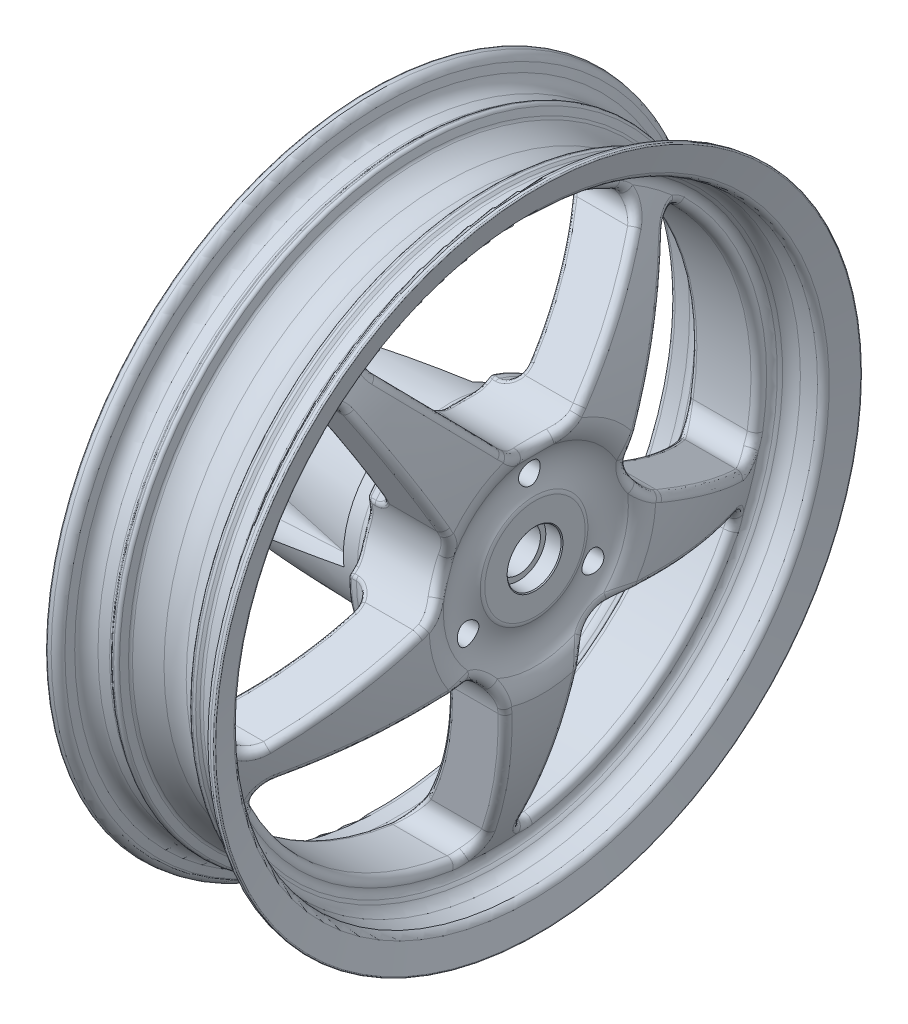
SolidWorks part; units mm, degrees
ref_plane "Plan de face" through (0, 0, 0) normal (0, 0, 1) x (1, 0, 0)
ref_plane "Plan de dessus" through (0, 0, 0) normal (0, 1, 0) x (1, 0, 0)
ref_plane "Plan de droite" through (0, 0, 0) normal (1, 0, 0) x (0, 0, -1)
sketch "Esquisse1" plane through (0, 0, 0) normal (0, 0, 1) x (1, 0, 0)
  line L0 (0, 0) -> (197.9907, 0) construction
  line L1 (0, 12) -> (0, 49)
  line L2 (0, 49) -> (71.1972, 51.8104)
  line L3 (76, 56.8065) -> (76, 60)
  line L4 (78, 62) -> (80.8642, 62)
  line L5 (-47.476, 147.5) -> (142.6594, 147.5) construction
  line L6 (26.2413, 179.0996) -> (29.9338, 165.3187)
  line L7 (26, 180) -> (26, -43.8427) construction
  line L8 (33.4489, 162.3692) -> (42.2177, 161.6021)
  line L9 (119.7587, 179.0996) -> (116.0662, 165.3187)
  line L10 (120, 180) -> (120, 33.2219) construction
  line L11 (112.5511, 162.3692) -> (103.7823, 161.6021)
  line L12 (26, 180) -> (120, 180) construction
  line L13 (26.9194, 179.8468) -> (28.8254, 179.5291)
  line L14 (32.833, 175.8912) -> (33.9769, 171.6223)
  line L15 (41.007, 165.7233) -> (46.9739, 165.2012)
  line L16 (48.4338, 165.6615) -> (49.7144, 166.7361)
  line L17 (51, 167.204) -> (51.2, 167.204)
  line L18 (53.0913, 165.8544) -> (54.3647, 162.1511)
  line L19 (73, 180) -> (73, 147.5) construction
  line L20 (92.9087, 165.8544) -> (91.6353, 162.1511)
  line L21 (95, 167.204) -> (94.8, 167.204)
  line L22 (97.5662, 165.6615) -> (96.2856, 166.7361)
  line L23 (104.993, 165.7233) -> (99.0261, 165.2012)
  line L24 (113.167, 175.8912) -> (112.0231, 171.6223)
  line L25 (119.0806, 179.8468) -> (117.1746, 179.5291)
  line L26 (118, 12) -> (118, 27.8791)
  line L27 (0, 12) -> (118, 12)
  arc A0 (48.7941, 158.313) -> (54.3276, 153.3994) centre (73, 180) ccw
  arc A1 (42.2177, 161.6021) -> (48.7941, 158.313) centre (41.3461, 151.6401) cw
  arc A2 (103.7823, 161.6021) -> (97.2059, 158.313) centre (104.6539, 151.6401) ccw
  arc A3 (29.9338, 165.3187) -> (33.4489, 162.3692) centre (33.7975, 166.354) ccw
  arc A4 (116.0662, 165.3187) -> (112.5511, 162.3692) centre (112.2025, 166.354) cw
  arc A5 (33.9769, 171.6223) -> (41.007, 165.7233) centre (41.7043, 173.6928) ccw
  arc A6 (46.9739, 165.2012) -> (48.4338, 165.6615) centre (47.1482, 167.1936) ccw
  arc A7 (49.7144, 166.7361) -> (51, 167.204) centre (51, 165.204) cw
  arc A8 (53.0913, 165.8544) -> (51.2, 167.204) centre (51.2, 165.204) ccw
  arc A9 (55.265, 160.8356) -> (73, 154) centre (73.9861, 182.9832) ccw
  arc A10 (54.3647, 162.1511) -> (55.265, 160.8356) centre (57.2017, 163.1267) ccw
  arc A11 (28.8254, 179.5291) -> (32.833, 175.8912) centre (28.0034, 174.5971) cw
  arc A12 (26.2413, 179.0996) -> (26.9194, 179.8468) centre (26.8208, 179.2549) cw
  arc A13 (90.735, 160.8356) -> (73, 154) centre (72.0139, 182.9832) cw
  arc A14 (91.6353, 162.1511) -> (90.735, 160.8356) centre (88.7983, 163.1267) cw
  arc A15 (92.9087, 165.8544) -> (94.8, 167.204) centre (94.8, 165.204) cw
  arc A16 (96.2856, 166.7361) -> (95, 167.204) centre (95, 165.204) ccw
  arc A17 (99.0261, 165.2012) -> (97.5662, 165.6615) centre (98.8518, 167.1936) cw
  arc A18 (112.0231, 171.6223) -> (104.993, 165.7233) centre (104.2957, 173.6928) cw
  arc A19 (117.1746, 179.5291) -> (113.167, 175.8912) centre (117.9966, 174.5971) ccw
  arc A20 (119.7587, 179.0996) -> (119.0806, 179.8468) centre (119.1792, 179.2549) ccw
  arc A21 (88.7655, 71.2525) -> (55.5183, 152.2206) centre (-98.8916, 41.5065) ccw
  arc A22 (80.8642, 62) -> (88.7655, 71.2525) centre (80.8642, 70) ccw
  arc A23 (95.7617, 156.8018) -> (97.2059, 158.313) centre (73, 180) ccw
  arc A24 (54.3276, 153.3994) -> (55.5183, 152.2206) centre (51.4549, 149.307) cw
  arc A25 (94.8259, 150.9292) -> (122.1189, 62.907) centre (-135.9326, 31.1354) cw
  arc A26 (95.7617, 156.8018) -> (94.8259, 150.9292) centre (99.2635, 153.2329) ccw
  arc A27 (122.1189, 62.907) -> (118.4612, 51.3757) centre (102.1189, 62.9052) cw
  arc A28 (117.4673, 29.8736) -> (118.4612, 51.3757) centre (134.8036, 39.8462) cw
  arc A29 (117.4673, 29.8736) -> (118, 27.8791) centre (114, 27.8791) cw
  arc A30 (71.1972, 51.8104) -> (76, 56.8065) centre (71, 56.8065) ccw
  arc A31 (76, 60) -> (78, 62) centre (78, 60) cw
  point P24 (30.6587, 162.6133)
  point P27 (115.3413, 162.6133)
  point P49 (32, 179)
  point P79 (90, 62)
  point P82 (55, 152.9399)
  point P88 (93, 154.3826)
  point P95 (118, 29)
  point P100 (76, 52)
  point P103 (76, 62)
  dimension "D8" = 162.6133
  dimension "D7" = 10
  dimension "D17" = 4
  dimension "D21" = 8
  dimension "D22" = 2
  dimension "D26" = 29
  dimension "D28" = 3
  dimension "D29" = 5
  dimension "D30" = 0.6
  dimension "D32" = 8
  dimension "D34" = 32.5
  dimension "D35" = 190
  dimension "D36" = 5
  dimension "D38" = 5
  dimension "D41" = 20
  dimension "D43" = 260
  dimension "D44" = 4
  dimension "D47" = 5
  dimension "D48" = 2
  dimension "D50" = 20
  dimension "D1" = 49
  dimension "D2" = 62
  dimension "D3" = 10
  dimension "D4" = 76
  dimension "D5" = 14
  dimension "D6" = 147.5
  dimension "D9" = 26
  dimension "D10" = 15
  dimension "D11" = 180
  dimension "D12" = 18
  dimension "D13" = 110
  dimension "D14" = 94
  dimension "D15" = 15
  dimension "D16" = 18
  dimension "D18" = 110
  dimension "D19" = 6
  dimension "D20" = 1
  dimension "D23" = 25
  dimension "D24" = 4
  dimension "D25" = 26
  dimension "D27" = 0.2
  dimension "D31" = 47
  dimension "D33" = 18
  dimension "D37" = 20
  dimension "D39" = 118
  dimension "D40" = 29
  dimension "D45" = 12
  dimension "D46" = 118
  dimension "D49" = 4
revolve "Révolution1" add sketch "Esquisse1" angle 360 about L0
sketch "Esquisse2" plane through (118, 0, 0) normal (1, 0, 0) x (0, 0, -1)
  line L0 (0, 0) -> (0, 179.0996) construction
  line L1 (-71.0468, 114.7616) -> (-21.4525, 64.0289)
  line L2 (71.0468, 114.7616) -> (21.4525, 64.0289)
  line L3 (87.1901, 103.0328) -> (54.2659, 40.1886)
  line L4 (131.0995, -32.1063) -> (67.5243, -0.6166)
  line L5 (124.9333, -51.0838) -> (54.9907, -39.191)
  line L6 (9.9771, -134.6044) -> (20.2798, -64.4099)
  line L7 (-9.9771, -134.6044) -> (-20.2798, -64.4099)
  line L8 (-124.9333, -51.0838) -> (-54.9907, -39.191)
  line L9 (-131.0995, -32.1063) -> (-67.5243, -0.6166)
  line L10 (-87.1901, 103.0328) -> (-54.2659, 40.1886)
  circle A0 centre (0, 0) radius 55 construction
  circle A1 centre (0, 0) radius 179.0996 construction
  arc A2 (-21.4525, 64.0289) -> (21.4525, 64.0289) centre (0, 85) ccw
  arc A3 (68.543, 130.6067) -> (-68.543, 130.6067) centre (0, 0) ccw
  arc A4 (-68.543, 130.6067) -> (-71.0468, 114.7616) centre (-63.896, 121.752) ccw
  arc A5 (68.543, 130.6067) -> (71.0468, 114.7616) centre (63.896, 121.752) cw
  arc A6 (103.0334, 105.5479) -> (87.1901, 103.0328) centre (96.0481, 98.3921) ccw
  arc A7 (145.3953, -24.8285) -> (103.0334, 105.5479) centre (0, 0) ccw
  arc A8 (145.3953, -24.8285) -> (131.0995, -32.1063) centre (135.538, -23.1452) cw
  arc A9 (54.2659, 40.1886) -> (67.5243, -0.6166) centre (80.8398, 26.2664) ccw
  arc A10 (132.2211, -65.3745) -> (124.9333, -51.0838) centre (123.257, -60.9423) ccw
  arc A11 (21.3163, -145.9516) -> (132.2211, -65.3745) centre (0, 0) ccw
  arc A12 (21.3163, -145.9516) -> (9.9771, -134.6044) centre (19.8711, -136.0566) cw
  arc A13 (54.9907, -39.191) -> (20.2798, -64.4099) centre (49.9617, -68.7664) ccw
  arc A14 (-21.3163, -145.9516) -> (-9.9771, -134.6044) centre (-19.8711, -136.0566) ccw
  arc A15 (-132.2211, -65.3745) -> (-21.3163, -145.9516) centre (0, 0) ccw
  arc A16 (-132.2211, -65.3745) -> (-124.9333, -51.0838) centre (-123.257, -60.9423) cw
  arc A17 (-20.2798, -64.4099) -> (-54.9907, -39.191) centre (-49.9617, -68.7664) ccw
  arc A18 (-145.3953, -24.8285) -> (-131.0995, -32.1063) centre (-135.538, -23.1452) ccw
  arc A19 (-103.0334, 105.5479) -> (-145.3953, -24.8285) centre (0, 0) ccw
  arc A20 (-103.0334, 105.5479) -> (-87.1901, 103.0328) centre (-96.0481, 98.3921) cw
  arc A21 (-67.5243, -0.6166) -> (-54.2659, 40.1886) centre (-80.8398, 26.2664) ccw
  point P13 (-80, 123.9203)
  point P17 (80, 123.9203)
  dimension "D1" = 110
  dimension "D2" = 295
  dimension "D5" = 80
  dimension "D7" = 60
  dimension "D3" = 60
  dimension "D4" = 80
  dimension "D6" = 10
extrude "Extrusion1" cut sketch "Esquisse2" against normal mid plane 190
fillet "Congé3" radius 25 1 edges at (73, 0, 154)
fillet "Congé21" radius 4 40 edges at (98.4381, 123.3155, -73.773) (96.5739, 147.5, 0) (97.8143, 125.0789, 73.3264) (97.8143, -31.086, 141.6162) (96.5739, 45.58, 140.2808) (98.4381, 108.2689, 94.483) (120.5862, 14.2208, 53.3643) (120.6813, 55.2986, -4.2223) (97.8143, -144.2911, 14.1973) (96.5739, -119.33, 86.6983) (98.4381, -56.4017, 132.1667) (98.4381, -143.127, -12.7994) (96.5739, -119.33, -86.6983) (97.8143, -58.0908, -132.8418) (98.4381, -32.0557, -140.0771) (96.5739, 45.58, -140.2808) (97.8143, 108.389, -96.298) (120.5027, 18.0065, -51.9993) (120.6927, -47.3097, -28.9949) (120.5862, -46.3581, 30.0152)
sketch "Esquisse3" plane through (0, 0, 0) normal (-1, 0, 0) x (0, 0, 1)
  line L0 (0, 0) -> (0, 79.7411) construction
  circle A0 centre (0, 40) radius 5.1
  circle A1 centre (34.641, -20) radius 5.1
  circle A2 centre (-34.641, -20) radius 5.1
  dimension "D2" = 10.2
  dimension "D1" = 40
extrude "Extrusion2" cut sketch "Esquisse3" against normal blind 0.01
hole_wizard "Trou taraudé M101" positions "Esquisse3D1" profile "Esquisse4" tap size "M10" standard "Iso"
sketch3d "Esquisse3D1"
  line L0 (0.01, 40, 0) -> (0, 40, 0) construction
  line L1 (0.01, -20, 34.641) -> (0, -20, 34.641) construction
  line L2 (0.01, -20, -34.641) -> (0, -20, -34.641) construction
  point P0 (0.01, 40, 0)
  point P4 (0.01, -20, 34.641)
  point P8 (0, -20, -34.641)
sketch "Esquisse4" plane through (0.01, 40, 0) normal (0, 1, 0) x (0, 0, 1)
  line L0 (0, 0) -> (0, 37.5537)
  line L1 (0, 37.5537) -> (4.25, 35)
  line L2 (4.25, 35) -> (4.25, 0)
  line L5 (4.25, 0) -> (0, 0)
  line L10 (0, 37.5537) -> (-4.25, 35) construction
  line L11 (0, -6.35) -> (0, 107.95) construction
  dimension "Diamètre du trou pour taraudage" = 8.5
  dimension "Profondeur du trou pour taraudage" = 35
  dimension "Angle de pointe" = 118
fillet "Congé27" radius 3 80 edges at (61.0506, -56.843, -132.3781) (58.7961, -119.33, -86.6983) (61.7715, -142.4157, -12.1535) (85.0576, -59.435, -21.4499) (79.4321, -57.9773, -21.969) (79.4321, -38.8097, -48.3509) (76.5778, -57.2254, -22.2705) (76.9936, -38.8317, -47.9842) (76, -52.7909, -24.5692) (76, -39.68, -42.6149) (75.7165, -45.9766, -30.4522) (84.6398, -38.7687, -49.5915) (88.8564, -39.5846, -57.3056) (85.0576, -38.7665, 49.8976) (79.4321, -38.8097, 48.3509) (79.4321, -57.9773, 21.969) (76.5778, -38.8641, 47.5426) (76.9936, -57.6354, 22.1032) (76, -39.68, 42.6149) (76, -52.7909, 24.5692) (75.7327, -42.9859, 34.6201) (84.6398, -59.1445, 21.5466) (88.6632, -65.1686, 20.1684) (61.0506, -143.4645, 13.1538) (58.7961, -119.33, 86.6983) (61.7715, -55.5675, 131.6897) (61.7715, 108.0731, 93.5422) (85.0576, 35.4759, 52.2884) (79.4321, 33.9915, 51.8515) (79.4321, 2.9778, 61.9284) (76.5778, 33.206, 51.6535) (76.9936, 3.2111, 61.6448) (76, 28.2674, 50.9066) (76, 7.0534, 57.7995) (75.6907, 15.3859, 52.8824) (84.6399, 2.2154, 62.908) (88.69, -1.0168, 68.3324) (61.0506, -31.823, 140.5076) (61.7715, 122.3603, -73.8775) (85.0576, 60.6918, -17.5816) (79.4321, 59.8176, -16.3049) (79.4321, 59.8176, 16.3049) (76.5778, 59.3866, -15.619) (76.9936, 59.6199, 15.9954) (76, 57.1502, -11.1529) (76, 57.1502, 11.1529) (75.7493, 55.1578, 3.0726) (84.6399, 60.5137, 17.3327) (61.0506, 123.7969, 73.6847) (61.0506, 108.3336, -94.9681) (58.7961, 45.58, -140.2808) (61.7715, -32.4502, -139.201) (88.8512, -2.0535, -70.4253) (85.0576, 2.0337, -63.1544) (79.4321, 2.9778, -61.9284) (79.4321, 33.9915, -51.8515) (76.5778, 3.4969, -61.3066) (76.9936, 33.6361, -51.7591) (76, 7.0534, -57.7995) (76, 28.2674, -50.9066) (75.7165, 14.7543, -53.1366) (84.6399, 35.1841, -52.1959) (88.8564, 42.2686, -55.3556) (58.7961, 45.58, 140.2808) (58.7961, 147.5, 0)
sketch "Esquisse5" plane through (0, 0, 0) normal (-1, 0, 0) x (0, 0, 1)
  circle A0 centre (0, 0) radius 17.5
  dimension "D1" = 35
extrude "Extrusion3" cut sketch "Esquisse5" against normal blind 16
sketch "Esquisse6" plane through (0, 0, 0) normal (-1, 0, 0) x (0, 0, 1)
  circle A0 centre (0, 0) radius 29.15
  dimension "D1" = 58.3
extrude "Extrusion4" cut sketch "Esquisse6" against normal blind 3 flip side to cut
sketch "Esquisse7" plane through (3, 0, 0) normal (-1, 0, 0) x (0, 0, 1)
  arc A0 (-15.5599, 31.3511) -> (-34.9308, -2.2003) centre (0, 0) ccw
  arc A1 (8.9549, 40.9) -> (-8.9549, 40.9) centre (0, 40) ccw
  arc A2 (30.943, -28.2052) -> (39.8979, -12.6948) centre (34.641, -20) ccw
  arc A3 (-39.8979, -12.6948) -> (-30.943, -28.2052) centre (-34.641, -20) ccw
  arc A4 (34.9308, -2.2003) -> (15.5599, 31.3511) centre (0, 0) ccw
  arc A5 (-19.3709, -29.1508) -> (19.3709, -29.1508) centre (0, 0) ccw
  arc A6 (-34.9308, -2.2003) -> (-39.8979, -12.6948) centre (-46.907, -2.9546) cw
  arc A7 (-19.3709, -29.1508) -> (-30.943, -28.2052) centre (-26.0123, -39.1454) ccw
  arc A8 (30.943, -28.2052) -> (19.3709, -29.1508) centre (26.0123, -39.1454) ccw
  arc A9 (34.9308, -2.2003) -> (39.8979, -12.6948) centre (46.907, -2.9546) ccw
  arc A10 (8.9549, 40.9) -> (15.5599, 31.3511) centre (20.8947, 42.1) ccw
  arc A11 (-15.5599, 31.3511) -> (-8.9549, 40.9) centre (-20.8947, 42.1) ccw
  circle A12 centre (0, 0) radius 75
  circle A13 centre (0, 40) radius 4.25 construction
  circle A14 centre (34.641, -20) radius 4.25 construction
  circle A15 centre (-34.641, -20) radius 4.25 construction
  point P18 (-26.2222, -23.1818)
  point P23 (33.1871, -11.1182)
  dimension "D1" = 70
  dimension "D2" = 18
  dimension "D3" = 18
  dimension "D4" = 18
  dimension "D5" = 12
  dimension "D6" = 12
  dimension "D7" = 150
extrude "Extrusion5" cut sketch "Esquisse7" against normal blind 60 draft 12
ref_plane "Plan milieu" through (73, 0, 0) normal (-1, 0, 0) x (0, 0, 1)
sketch "Esquisse8" plane through (16, 0, 0) normal (-1, 0, 0) x (0, 0, 1)
  circle A0 centre (0, 0) radius 15
  dimension "D1" = 30
extrude "Enlèv. mat.-Extru.1" cut sketch "Esquisse8" against normal blind 9
sketch "Esquisse10" plane through (118, 0, 0) normal (1, 0, 0) x (0, 0, -1)
  circle A0 centre (0, 0) radius 15
  dimension "D1" = 30
extrude "Enlèv. mat.-Extru.3" cut sketch "Esquisse10" against normal blind 9
sketch "Esquisse12" plane through (118, 0, 0) normal (1, 0, 0) x (0, 0, -1)
  circle A0 centre (0, 40) radius 6
  circle A1 centre (34.641, -20) radius 6
  circle A2 centre (-34.641, -20) radius 6
  dimension "D1" = 12
extrude "Enlèv. mat.-Extru.5" cut sketch "Esquisse12" against normal blind 18
chamfer "Chanfrein1" distance 0.5 angle 45 2 edges at (16, 0, 15) (118, 0, -15)
hole_wizard "Trou taraudé M102" positions "Esquisse14" profile "Esquisse13" tap size "M10" standard "Iso"
sketch "Esquisse14" plane through (100, 0, 0) normal (1, 0, 0) x (0, 0, -1)
  circle A0 centre (0, 40) radius 6 construction
  circle A1 centre (-34.641, -20) radius 6 construction
  circle A2 centre (34.641, -20) radius 6 construction
  point P0 (0, 40)
  point P2 (-34.641, -20)
  point P4 (34.641, -20)
sketch "Esquisse13" plane through (100, 40, 0) normal (0, 1, 0) x (0, 0, -1)
  line L0 (0, 0) -> (0, 27.5537)
  line L1 (0, 27.5537) -> (4.25, 25)
  line L2 (4.25, 25) -> (4.25, 0)
  line L5 (4.25, 0) -> (0, 0)
  line L10 (0, 27.5537) -> (-4.25, 25) construction
  line L11 (0, -6.35) -> (0, 107.95) construction
  dimension "Diamètre du trou pour taraudage" = 8.5
  dimension "Profondeur du trou pour taraudage" = 25
  dimension "Angle de pointe" = 118
